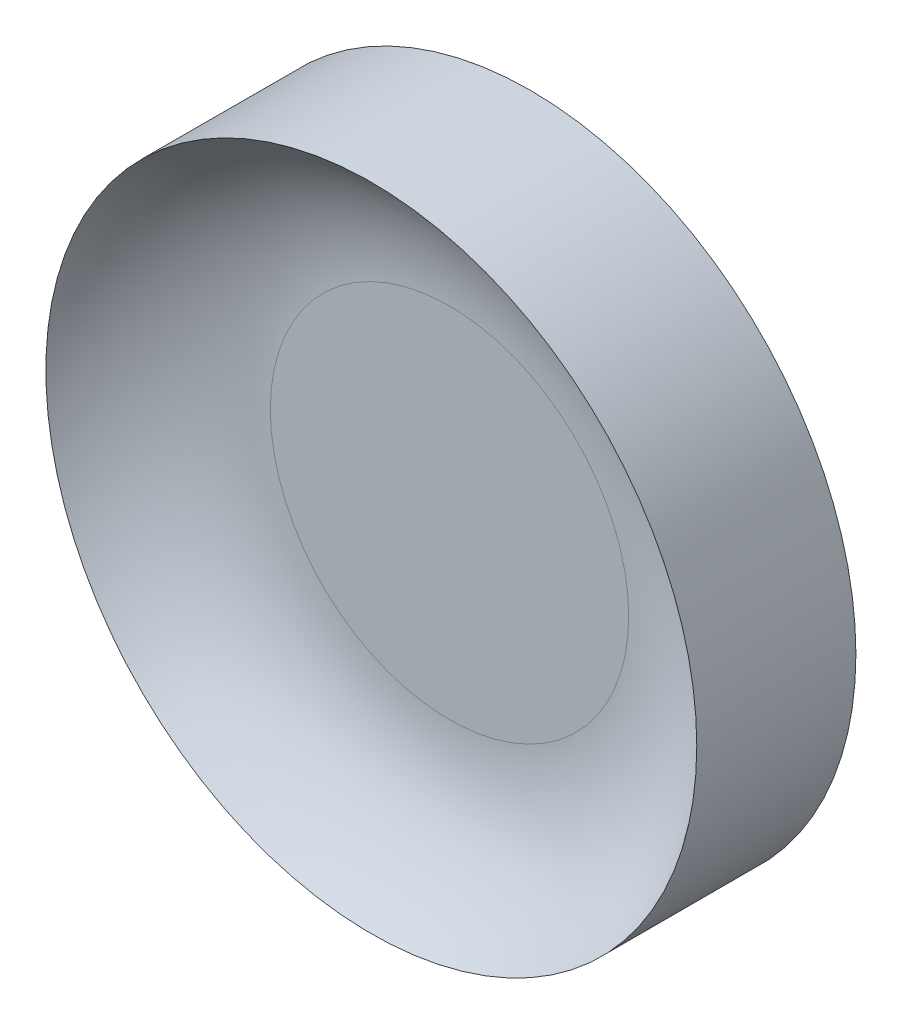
SolidWorks part; units mm, degrees
ref_plane "Plan1" through (0, 0, 0) normal (0, 0, 1) x (1, 0, 0)
ref_plane "Plan2" through (0, 0, 0) normal (0, 1, 0) x (1, 0, 0)
ref_plane "Plan3" through (0, 0, 0) normal (1, 0, 0) x (0, 0, -1)
sketch "Esquisse1" plane through (0, 0, 0) normal (0, 0, 1) x (1, 0, 0)
  circle A0 centre (0, 0) radius 16.2
  dimension "D1" = 32.4
extrude "Base-Extrusion" add sketch "Esquisse1" along normal mid plane 16.3 draft 4
sketch "Esquisse2" plane through (0, 0, 0) normal (0, 0, 1) x (1, 0, 0)
  line L0 (-20, 0) -> (20, 0) construction
  line L1 (-20, -8) -> (94.3291, -8) construction
  line L2 (0, -15.7) -> (88.1673, -15.7)
  line L3 (90.1597, -13.8743) -> (90.6737, -8)
  line L4 (0, -15.7) -> (0, -8)
  line L5 (0, -8) -> (90.6737, -8)
  circle A0 centre (0, 0) radius 15.6301 construction
  arc A1 (90.1597, -13.8743) -> (88.1673, -15.7) centre (88.1673, -13.7) cw
  point P13 (90, -15.7)
  dimension "D5" = 2
  dimension "D1" = 8
  dimension "D2" = 7.7
  dimension "D3" = 95
  dimension "D4" = 90
revolve "Boss.-Révol.1" add sketch "Esquisse2" angle 360 about L1
fillet "Congé4" radius 1
fillet "Congé5" radius 20
sketch "Esquisse3" plane through (0, 0, 0) normal (0, 1, 0) x (1, 0, 0)
  line L0 (0, 20.6238) -> (0, -15.1969) construction
  line L1 (0, 0) -> (0, -7.2198) construction
  line L2 (11.7426, -8.15) -> (0, -8.15)
  line L3 (0, 2.85) -> (0, -8.15)
  line L4 (-14.6976, -8.15) -> (14.6976, -8.15) construction
  line L5 (9, 2.85) -> (11.7426, -8.15)
  line L7 (-32.9547, 0) -> (48.0586, 0) construction
  line L8 (-20, 0) -> (94.3291, 0) construction
  line L9 (0, 2.85) -> (9, 2.85)
  dimension "D2" = 9
  dimension "D1" = 14
  dimension "D4" = 11
revolve "Enlèvement de matière-Révolution1" cut sketch "Esquisse3" angle 360 about L0
fillet "Congé13" radius 5
fillet "Congé15" radius 2
sketch "Esquisse5" plane through (0, 0, 0) normal (0, 1, 0) x (1, 0, 0)
  line L0 (0, 16.1009) -> (0, -12.7842) construction
  line L1 (0, 0) -> (0, -7.2198) construction
  line L2 (0, 5.15) -> (10.8, 5.15)
  line L4 (0, 8.15) -> (0, 5.15)
  line L5 (10.8, 5.15) -> (11.548, 8.15)
  line L6 (11.548, 8.15) -> (0, 8.15)
  line L7 (14.6976, 8.15) -> (-14.6976, 8.15) construction
  dimension "D3" = 14
  dimension "D2" = 10.8
  dimension "D1" = 3
revolve "Enlèvement de matière-Révolution2" cut sketch "Esquisse5" angle 360 about L0
fillet "Congé16" radius 2
fillet "Congé17" radius 2
scale "Echelle1"
sketch "Esquisse7" plane through (0, 0, 0) normal (0, 0, 1) x (1, 0, 0)
  line L0 (97.4644, -1.6368) -> (98.0316, -8.12)
  line L1 (97.4644, -14.6032) -> (98.0316, -8.12)
  line L24 (6.0879, -21.9105) -> (89.4898, -21.9105)
  line L25 (89.4898, 5.6705) -> (30.8393, 5.6705)
  arc A0 (3.7119, -22.1086) -> (6.0879, -21.9105) centre (6.0879, -36.2605) cw
  arc A1 (18.8032, 12.2068) -> (30.8393, 5.6705) centre (30.8393, 20.0205) ccw
  circle A2 centre (0, 0) radius 14
  arc A15 (89.4898, -21.9105) -> (97.4644, -14.6032) centre (89.4898, -13.9055) ccw
  arc A16 (18.8032, 12.2068) -> (3.7119, -22.1086) centre (0, 0) ccw
  arc A17 (97.4644, -1.6368) -> (89.4898, 5.6705) centre (89.4898, -2.3345) ccw
  dimension "D2" = 14.35
  dimension "D3" = 14.35
  dimension "D1" = 28
  dimension "D4" = 170
extrude "Boss.-Extru.1" add sketch "Esquisse7" along normal mid plane 1.2
sketch "Esquisse8" plane through (0, 0, 0) normal (0, 0, 1) x (1, 0, 0)
  line L0 (0, 0) -> (0, -82.1677) construction
  line L1 (0, -42.3205) -> (89.4898, -42.3205)
  line L16 (117.7967, -16.382) -> (118.5196, -8.12)
  line L17 (118.5196, -8.12) -> (117.7967, 0.142)
  line L18 (89.4898, 26.0805) -> (49.0921, 26.0805)
  line L20 (97.4644, -14.6032) -> (98.0316, -8.12)
  line L21 (98.0316, -8.12) -> (97.4644, -1.6368)
  line L22 (89.4898, 5.6705) -> (30.8393, 5.6705)
  line L23 (6.0879, -21.9105) -> (89.4898, -21.9105)
  line L24 (97.4644, -14.6032) -> (98.0316, -8.12)
  line L25 (98.0316, -8.12) -> (97.4644, -1.6368)
  line L26 (89.4898, 5.6705) -> (30.8393, 5.6705)
  line L27 (6.0879, -21.9105) -> (89.4898, -21.9105)
  arc A0 (25.238, 33.9716) -> (0, -42.3205) centre (0, 0) ccw
  arc A1 (49.0921, 26.0805) -> (25.238, 33.9716) centre (49.0921, 66.0805) cw
  arc A18 (89.4898, -42.3205) -> (117.7967, -16.382) centre (89.4898, -13.9055) ccw
  arc A19 (117.7967, 0.142) -> (89.4898, 26.0805) centre (89.4898, -2.3345) ccw
  arc A21 (89.4898, -21.9105) -> (97.4644, -14.6032) centre (89.4898, -13.9055) ccw
  arc A22 (97.4644, -1.6368) -> (89.4898, 5.6705) centre (89.4898, -2.3345) ccw
  arc A23 (18.8032, 12.2068) -> (30.8393, 5.6705) centre (30.8393, 20.0205) ccw
  arc A24 (18.8032, 12.2068) -> (3.7119, -22.1086) centre (0, 0) ccw
  arc A25 (6.0879, -21.9105) -> (3.7119, -22.1086) centre (6.0879, -36.2605) ccw
  arc A26 (89.4898, -21.9105) -> (97.4644, -14.6032) centre (89.4898, -13.9055) ccw
  arc A27 (97.4644, -1.6368) -> (89.4898, 5.6705) centre (89.4898, -2.3345) ccw
  arc A28 (18.8032, 12.2068) -> (30.8393, 5.6705) centre (30.8393, 20.0205) ccw
  arc A29 (18.8032, 12.2068) -> (3.7119, -22.1086) centre (0, 0) ccw
  arc A30 (6.0879, -21.9105) -> (3.7119, -22.1086) centre (6.0879, -36.2605) ccw
  dimension "D2" = 0
  dimension "D1" = 28.415
  dimension "D3" = 28.415
  dimension "D4" = 40
extrude "Boss.-Extru.2" add sketch "Esquisse8" along normal mid plane 8
fillet "Congé9" radius 4
fillet "Congé10" radius 4
draft "Dépouille1" type of draft neutral plane draft angle 60 faces to draft 9 parameters "D1"=60
draft "Dépouille3" type of draft neutral plane draft angle 60 faces to draft 9 parameters "D1"=60
fillet "Congé11" radius 2
fillet "Congé12" radius 2
sketch "Esquisse9" plane through (0, 0, 0) normal (0, 0, 1) x (1, 0, 0)
  circle A1 centre (0, 0) radius 9.39
  dimension "D1" = 18.78
extrude "Enlèv. mat.-Extru.1" cut sketch "Esquisse9" against normal mid plane 30 flip side to cut
